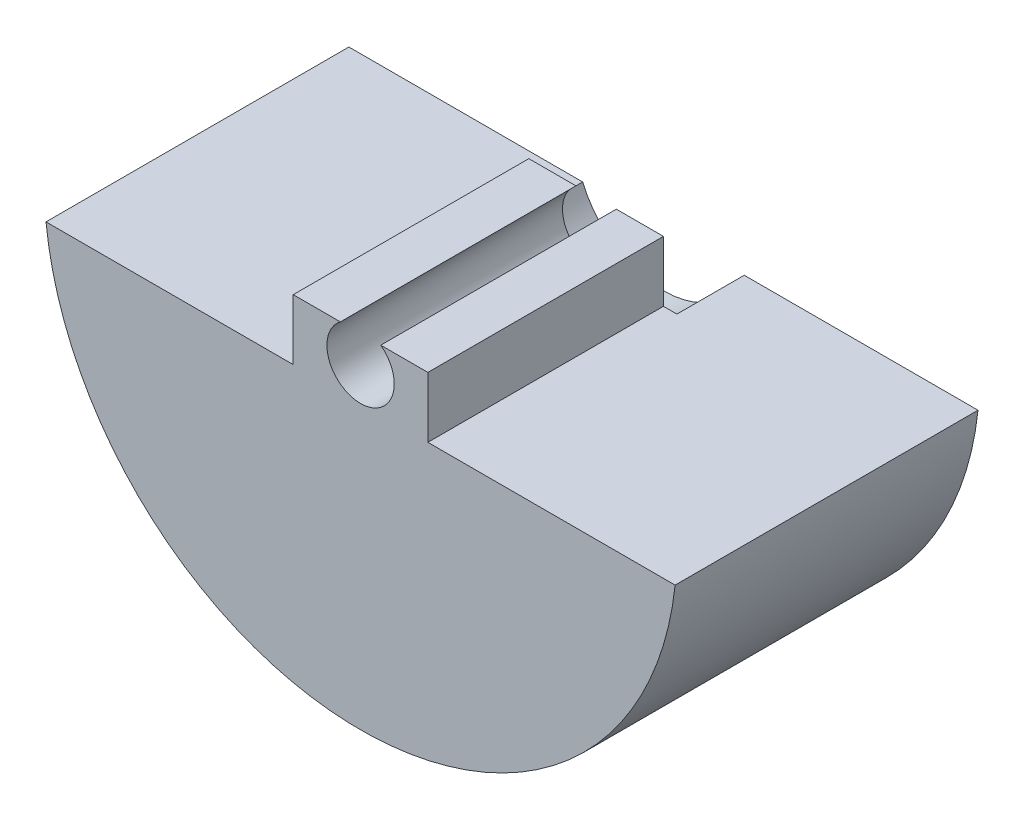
SolidWorks part; units mm, degrees
ref_plane "Face" through (0, 0, 0) normal (0, 0, 1) x (1, 0, 0)
ref_plane "Dessus" through (0, 0, 0) normal (0, 1, 0) x (1, 0, 0)
ref_plane "Droite" through (0, 0, 0) normal (1, 0, 0) x (0, 0, -1)
sketch "Esquisse1" plane through (0, 0, 0) normal (0, 0, 1) x (1, 0, 0)
  line L0 (0.3, 0.4) -> (1, 0.4)
  line L1 (-1, -0.5) -> (-1, 0.4)
  line L2 (-1, 0.4) -> (-0.3, 0.4)
  line L3 (1, 0.4) -> (1, -0.5)
  line L5 (0, 0) -> (0, 32.7797) construction
  line L6 (-4.6733, -0.5) -> (-1, -0.5)
  line L7 (1, -0.5) -> (4.6733, -0.5)
  arc A0 (-4.6733, -0.5) -> (4.6733, -0.5) centre (0, 0) ccw
  arc A1 (-0.3, 0.4) -> (0.3, 0.4) centre (0, 0) ccw
  dimension "D1" = 1
  dimension "D3" = 4.7
  dimension "D2" = 2
  dimension "D4" = 0.5
  dimension "D5" = 0.4
extrude "Extrusion1" add sketch "Esquisse1" against normal blind 4.5
sketch "Esquisse2" plane through (0, 0, -4.5) normal (0, 0, -1) x (-1, 0, 0)
  circle A0 centre (0, 0) radius 1.3
  dimension "D1" = 2.6
extrude "Enlèv. mat.-Extru.1" cut sketch "Esquisse2" against normal blind 1
sketch "Esquisse3" plane through (0, 0, 0) normal (0, 0, 1) x (1, 0, 0)
  point P0 (0, -2.1)
  dimension "D1" = 2.1
